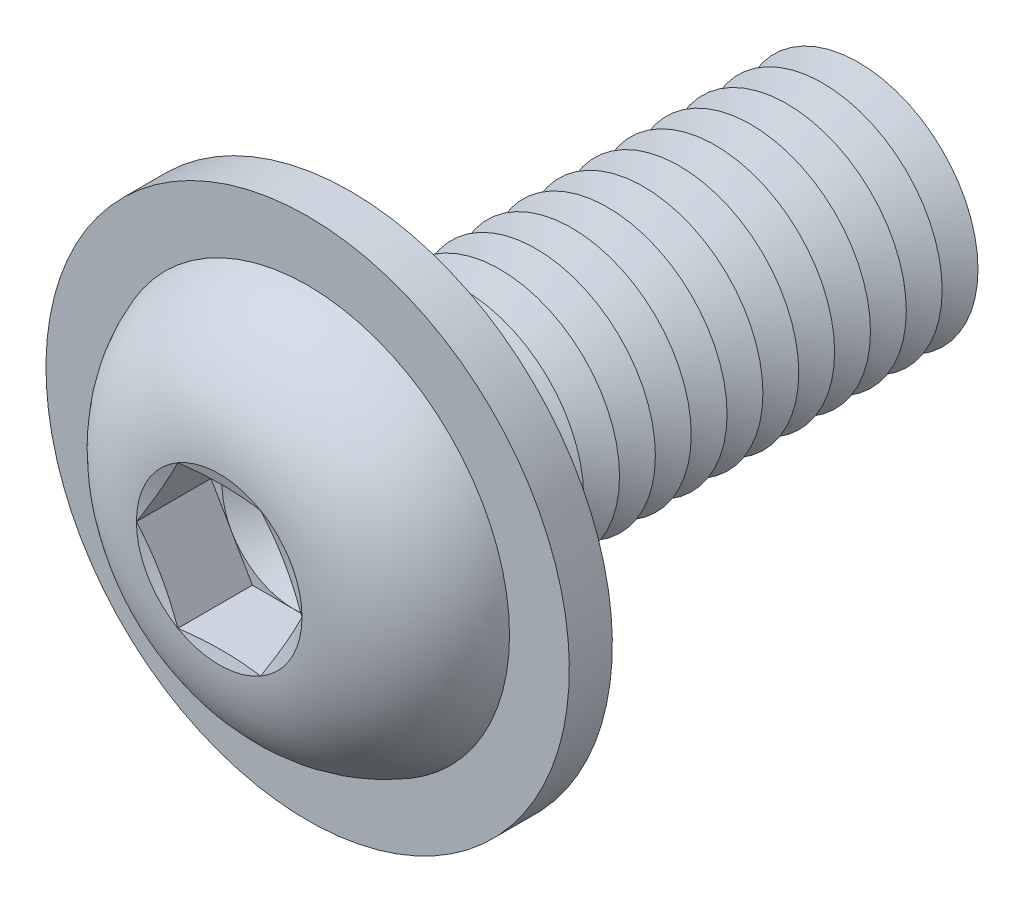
SolidWorks part; units mm, degrees
ref_plane "Front Plane" through (0, 0, 0) normal (0, 0, 1) x (1, 0, 0)
ref_plane "Top Plane" through (0, 0, 0) normal (0, 1, 0) x (1, 0, 0)
ref_plane "Right Plane" through (0, 0, 0) normal (1, 0, 0) x (0, 0, -1)
sketch "Sketch1" plane through (0, 0, 0) normal (1, 0, 0) x (0, 0, -1)
  line L0 (0, 5) -> (0, 8.75)
  line L3 (0, 5) -> (22, 5)
  line L4 (22, 5) -> (22, 0)
  line L5 (22, 0) -> (-5.5, 0) construction
  line L6 (-5.5, 0) -> (22, 0)
  line L7 (-5.5, 3.4641) -> (-5.5, 1.732) construction
  line L8 (-5.5, 1.732) -> (-5.5, 0)
  line L9 (-5.5, 3.4641) -> (-5.0359, 1.732)
  line L10 (-5.0359, 1.732) -> (-5.5, 1.732)
  line L11 (22, 0) -> (22.7481, 0) construction
  line L12 (0, 8.75) -> (-5.5, 8.75) construction
  arc A1 (0, 8.75) -> (-5.5, 3.4641) centre (0, 3.2457) ccw
  point P8 (22, 2.5)
  dimension "D1" = 17.5
  dimension "D2" = 10
  dimension "D3" = 5.5
  dimension "D4" = 6.9282
  dimension "D5" = 22
  dimension "D6" = 15
revolve "Revolve1" add sketch "Sketch1" angle 360 about L5
fillet "Fillet1" radius 0.75 1 edges at (-5, 0, 0)
sketch "Sketch2" plane through (0, 0, 0) normal (1, 0, 0) x (0, 0, -1)
  line L0 (21.25, 5) -> (22.75, 5)
  line L1 (22, 5) -> (0.75, 5) construction
  line L2 (22.75, 5) -> (22, 3.701)
  line L3 (22, -5) -> (22, 5) construction
  line L4 (22, 3.701) -> (21.25, 5)
  dimension "D1" = 1.5
revolve "Cut-Revolve1" cut sketch "Sketch2" angle 360 about axis through (0, 0, -22) along (0, 0, -1)
pattern_linear "LPattern1" count 14 spacing 1.5 along (0, 0, 1) of "Cut-Revolve1"
sketch "Sketch3" plane through (0, 0, 5.5) normal (0, 0, 1) x (1, 0, 0)
  line L7 (1.732, 3) -> (-1.7321, 3)
  line L8 (-1.7321, 3) -> (-3.4641, 0)
  line L9 (-3.4641, 0) -> (-1.732, -3)
  line L10 (-1.732, -3) -> (1.732, -3)
  line L11 (1.732, -3) -> (3.4641, 0)
  line L12 (3.4641, 0) -> (1.732, 3)
  circle A0 centre (0, 0) radius 3 construction
  circle A3 centre (0, 0) radius 3.4641 construction
extrude "Cut-Extrude1" cut sketch "Sketch3" against normal blind 3.12
sketch "Sketch4" plane through (0, 0, 2.38) normal (0, 0, 1) x (1, 0, 0)
  line L1 (1.732, 3) -> (-1.7321, 3) construction
  circle A0 centre (0, 0) radius 3
extrude "Cut-Extrude2" cut sketch "Sketch4" against normal through all draft 60
sketch "Sketch5" plane through (0, 0, 0) normal (0, 0, -1) x (-1, 0, 0)
  circle A0 centre (0, 0) radius 10.95
  circle A1 centre (0, 0) radius 5.75
  circle A2 centre (0, 0) radius 5.75 construction
  dimension "D1" = 21.9
extrude "Boss-Extrude1" add sketch "Sketch5" against normal blind 1.8
